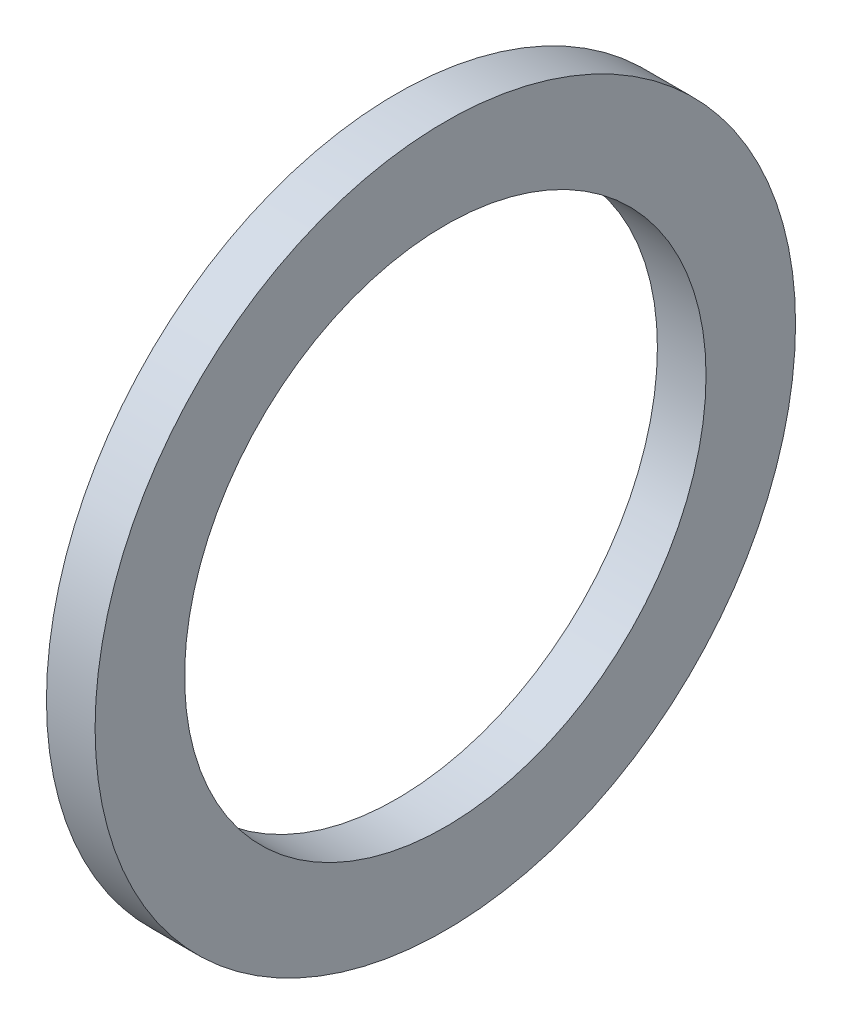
SolidWorks part; units mm, degrees
ref_plane "Face" through (0, 0, 0) normal (0, 0, 1) x (1, 0, 0)
ref_plane "Cote" through (0, 0, 0) normal (0, 1, 0) x (1, 0, 0)
ref_plane "Dessus" through (0, 0, 0) normal (1, 0, 0) x (0, 0, -1)
sketch "Esquisse1" plane through (0, 0, 0) normal (0, 0, 1) x (1, 0, 0)
  line L0 (0, 0) -> (-19.9358, 0) construction
  line L2 (-14.8458, 18) -> (-12.3458, 18)
  line L3 (-14.8458, 18) -> (-14.8458, 13.4)
  line L4 (-14.8458, 13.4) -> (-12.3458, 13.4)
  line L5 (-12.3458, 18) -> (-12.3458, 13.4)
  dimension "D1" = 26.8
  dimension "D2" = 36
  dimension "D3" = 2.5
revolve "Révolution1" add sketch "Esquisse1" angle 360 about L0
